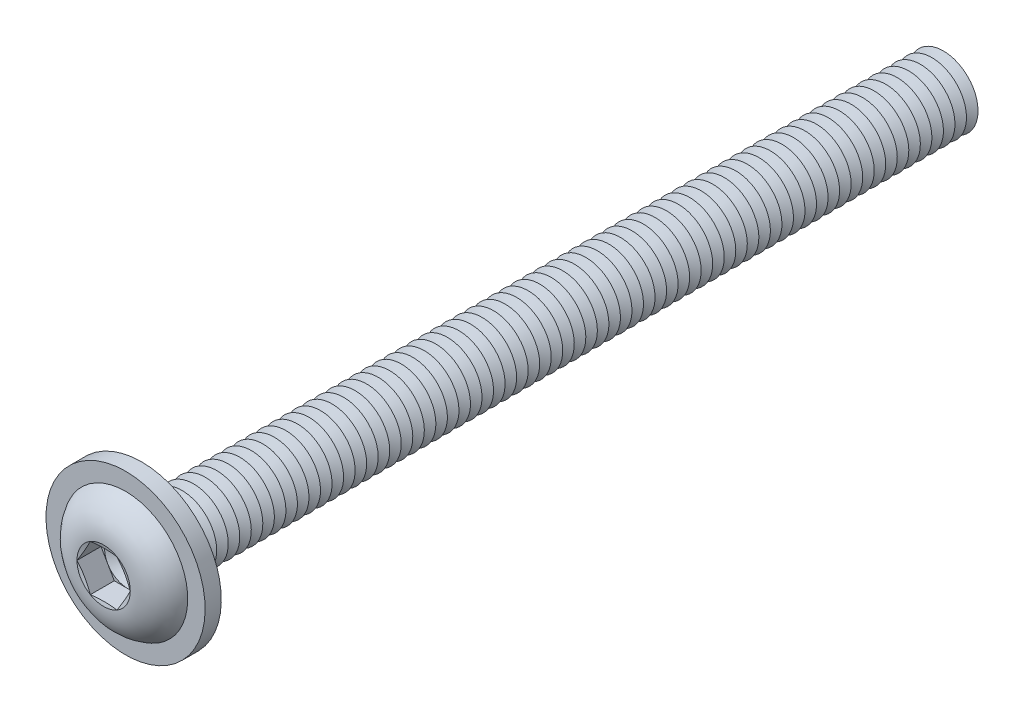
SolidWorks part; units mm, degrees
ref_plane "Front Plane" through (0, 0, 0) normal (0, 0, 1) x (1, 0, 0)
ref_plane "Top Plane" through (0, 0, 0) normal (0, 1, 0) x (1, 0, 0)
ref_plane "Right Plane" through (0, 0, 0) normal (1, 0, 0) x (0, 0, -1)
sketch "Sketch1" plane through (0, 0, 0) normal (1, 0, 0) x (0, 0, -1)
  line L0 (0, 1.5) -> (0, 2.85)
  line L3 (0, 1.5) -> (35, 1.5)
  line L4 (35, 1.5) -> (35, 0)
  line L5 (35, 0) -> (-1.65, 0) construction
  line L6 (-1.65, 0) -> (35, 0)
  line L7 (-1.65, 1.1547) -> (-1.65, 0.5773) construction
  line L8 (-1.65, 0.5773) -> (-1.65, 0)
  line L9 (-1.65, 1.1547) -> (-1.4953, 0.5773)
  line L10 (-1.4953, 0.5773) -> (-1.65, 0.5773)
  line L11 (35, 0) -> (22.7481, 0) construction
  line L12 (0, 2.85) -> (-1.65, 2.85) construction
  arc A1 (0, 2.85) -> (-1.65, 1.1547) centre (0, 1.1994) ccw
  point P8 (35, 0.75)
  dimension "D1" = 5.7
  dimension "D2" = 3
  dimension "D3" = 1.65
  dimension "D4" = 2.3094
  dimension "D5" = 35
  dimension "D6" = 15
revolve "Revolve1" add sketch "Sketch1" angle 360 about L5
fillet "Fillet1" radius 0.25 1 edges at (0, 1.5, 0)
sketch "Sketch2" plane through (0, 0, 0) normal (1, 0, 0) x (0, 0, -1)
  line L0 (34.75, 1.5) -> (35.25, 1.5)
  line L1 (35, 1.5) -> (0.25, 1.5) construction
  line L2 (35.25, 1.5) -> (35, 1.067)
  line L3 (35, -1.5) -> (35, 1.5) construction
  line L4 (35, 1.067) -> (34.75, 1.5)
  dimension "D1" = 0.5
revolve "Cut-Revolve1" cut sketch "Sketch2" angle 360 about axis through (0, 0, -35) along (0, 0, -1)
pattern_linear "LPattern1" count 70 spacing 0.5 along (0, 0, 1) of "Cut-Revolve1"
sketch "Sketch3" plane through (0, 0, 1.65) normal (0, 0, 1) x (1, 0, 0)
  line L7 (0.5773, 1) -> (-0.5774, 1)
  line L8 (-0.5774, 1) -> (-1.1547, 0)
  line L9 (-1.1547, 0) -> (-0.5773, -1)
  line L10 (-0.5773, -1) -> (0.5773, -1)
  line L11 (0.5773, -1) -> (1.1547, 0)
  line L12 (1.1547, 0) -> (0.5773, 1)
  circle A0 centre (0, 0) radius 1 construction
  circle A3 centre (0, 0) radius 1.1547 construction
extrude "Cut-Extrude1" cut sketch "Sketch3" against normal blind 1.04
sketch "Sketch4" plane through (0, 0, 0.61) normal (0, 0, 1) x (1, 0, 0)
  line L1 (0.5773, 1) -> (-0.5774, 1) construction
  circle A0 centre (0, 0) radius 1
extrude "Cut-Extrude2" cut sketch "Sketch4" against normal through all draft 60
sketch "Sketch5" plane through (0, 0, 0) normal (0, 0, -1) x (-1, 0, 0)
  circle A0 centre (0, 0) radius 3.45
  circle A1 centre (0, 0) radius 1.75
  circle A2 centre (0, 0) radius 1.75 construction
  dimension "D1" = 6.9
extrude "Boss-Extrude1" add sketch "Sketch5" against normal blind 0.7
